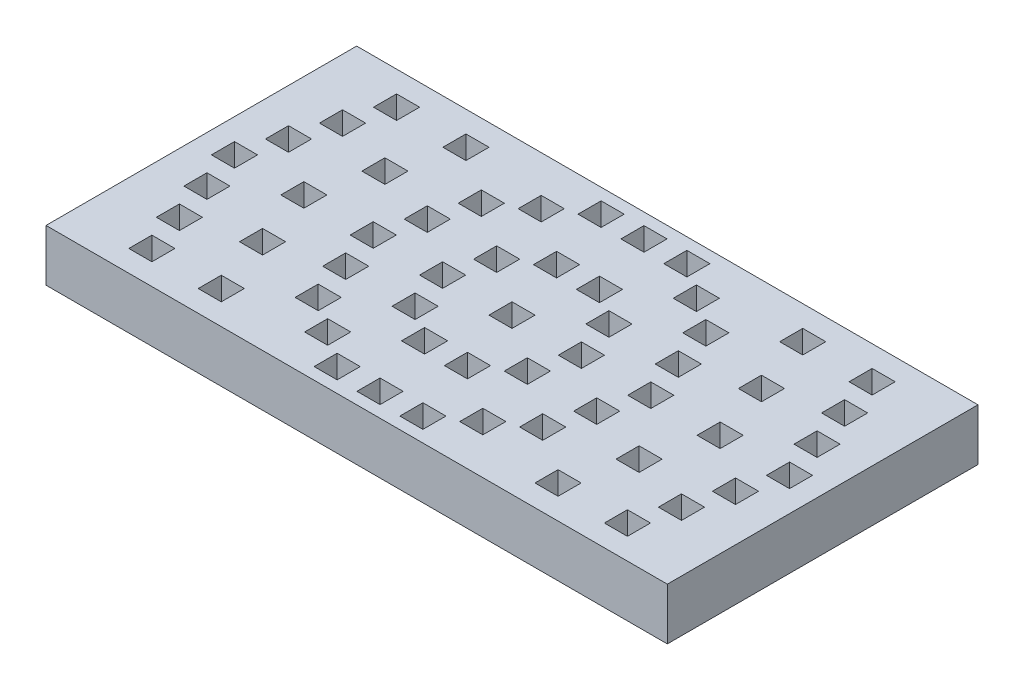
SolidWorks part; units mm, degrees
ref_plane "Front Plane" through (0, 0, 0) normal (0, 0, 1) x (1, 0, 0)
ref_plane "Top Plane" through (0, 0, 0) normal (0, 1, 0) x (1, 0, 0)
ref_plane "Right Plane" through (0, 0, 0) normal (1, 0, 0) x (0, 0, -1)
sketch "Sketch1" plane through (0, 0, 0) normal (0, 1, 0) x (1, 0, 0)
  line L1 (-76.2, 38.1) -> (76.2, 38.1)
  line L2 (-76.2, 38.1) -> (-76.2, -38.1)
  line L3 (-76.2, -38.1) -> (76.2, -38.1)
  line L4 (76.2, 38.1) -> (76.2, -38.1)
  dimension "D1" = 152.4
  dimension "D2" = 76.2
  dimension "D3" = 76.2
  dimension "D4" = 38.1
extrude "Extrude1" add sketch "Sketch1" along normal blind 12.7
other "Fill Pattern3" parameters "D8"=5.6569, "D5"=0, "D6"=0, "D4"=17.018, "D9"=55, "D3"=0
